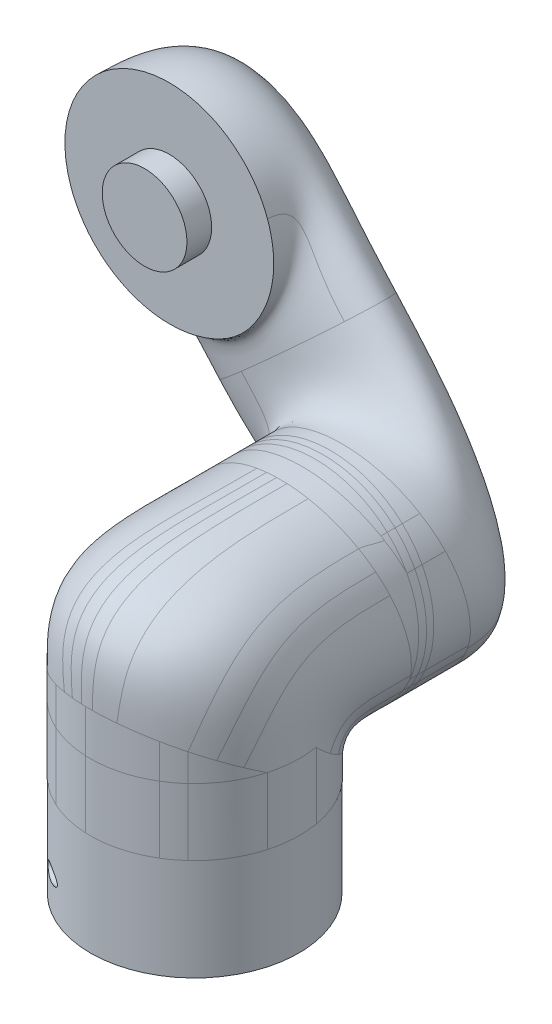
SolidWorks part; units mm, degrees
ref_plane "前视基准面" through (0, 0, 0) normal (0, 0, 1) x (1, 0, 0)
ref_plane "上视基准面" through (0, 0, 0) normal (0, 1, 0) x (1, 0, 0)
ref_plane "右视基准面" through (0, 0, 0) normal (1, 0, 0) x (0, 0, -1)
imported_body "输入1"
sketch "草图1" plane through (0, 0, -31.7494) normal (0, 0, 1) x (1, 0, 0)
  circle A0 centre (-49.5374, 45.2993) radius 42.262
  circle A1 centre (-49.5374, 45.2993) radius 17.15
  spline S0 degree 3 number of poles 68 (-9.7924, 59.6662) -> (-89.2606, 30.8722) construction
  spline S1 degree 3 number of poles 68 (-9.7924, 59.6662) -> (-89.2606, 30.8722)
  spline S2 degree 3 poles (1904.6401, 69.0479) (352.7628, -102.0182) (-74.7863, -68.8863) (-91.5199, 40.2563) (-91.6624, 41.6297) (-91.7749, 43.708) (-91.7956, 44.4051) (-91.8022, 45.8001) (-91.7883, 46.4949) (-91.6337, 49.9552) (-91.2418, 52.6808) (-90.4194, 56.0349) (-90.2382, 56.703) (-89.8415, 58.0339) (-89.6255, 58.6983) (-88.9303, 60.6698) (-88.4057, 61.951) (-86.6534, 65.6985) (-85.2496, 68.0696) (-83.193, 70.8705) (-82.7652, 71.4239) (-81.8867, 72.504) (-81.4357, 73.0312) (-80.0484, 74.5749) (-78.1072, 76.5327) (-75.9849, 78.2915) (-74.3245, 79.5352) (-73.7597, 79.9372) (-72.6065, 80.7156) (-72.0171, 81.0926) (-69.0421, 82.8929) (-66.5549, 84.0801) (-62.6674, 85.4914) (-61.3452, 85.8996) (-59.3214, 86.4163) (-58.6396, 86.5724) (-57.2778, 86.8492) (-56.5958, 86.9704) (-53.1803, 87.4911) (-50.4308, 87.6387) (-46.9723, 87.4847) (-46.2795, 87.4368) (-44.8918, 87.3061) (-44.1982, 87.2234) (-42.1368, 86.9261) (-40.781, 86.6618) (-36.7683, 85.6745) (-34.1654, 84.7592) (-30.3733, 82.9862) (-29.1455, 82.3359) (-26.7713, 80.9262) (-25.623, 80.166) (-23.4033, 78.5356) (-22.332, 77.6655) (-20.2679, 75.8129) (-19.2719, 74.8258) (-16.4659, 71.756) (-14.8167, 69.5507) (-12.6709, 66.0073) (-12.0098, 64.7849) (47.6121, -59.9345) (-505.0667, -442.0927) (-1649.0052, -1074.3051) knots -2.411715 -2.411715 -2.411715 -2.411715 0.0625 0.0625 0.09375 0.09375 0.109375 0.109375 0.125 0.125 0.1875 0.1875 0.203125 0.203125 0.21875 0.21875 0.25 0.25 0.3125 0.3125 0.328125 0.328125 0.34375 0.34375 0.375 0.40625 0.40625 0.421875 0.421875 0.4375 0.4375 0.5 0.5 0.53125 0.53125 0.546875 0.546875 0.5625 0.5625 0.625 0.625 0.640625 0.640625 0.65625 0.65625 0.6875 0.6875 0.75 0.75 0.78125 0.78125 0.8125 0.8125 0.84375 0.84375 0.875 0.875 0.9375 0.9375 0.96875 0.96875 4.032012 4.032012 4.032012 4.032012 only from (-89.2606, 30.8722) to (-9.7924, 59.6662) construction
  spline S3 degree 3 poles (-89.2606, 30.8722) (-90.214, 33.4974) (-90.8937, 36.1724) (-91.5199, 40.2563) (-91.6624, 41.6297) (-91.7749, 43.708) (-91.7956, 44.4051) (-91.8022, 45.8001) (-91.7883, 46.4949) (-91.6337, 49.9552) (-91.2418, 52.6808) (-90.4194, 56.0349) (-90.2382, 56.703) (-89.8415, 58.0339) (-89.6255, 58.6983) (-88.9303, 60.6698) (-88.4057, 61.951) (-86.6534, 65.6985) (-85.2496, 68.0696) (-83.193, 70.8705) (-82.7652, 71.4239) (-81.8867, 72.504) (-81.4357, 73.0312) (-80.0484, 74.5749) (-78.1072, 76.5327) (-75.9849, 78.2915) (-74.3245, 79.5352) (-73.7597, 79.9372) (-72.6065, 80.7156) (-72.0171, 81.0926) (-69.0421, 82.8929) (-66.5549, 84.0801) (-62.6674, 85.4914) (-61.3452, 85.8996) (-59.3214, 86.4163) (-58.6396, 86.5724) (-57.2778, 86.8492) (-56.5958, 86.9704) (-53.1803, 87.4911) (-50.4308, 87.6387) (-46.9723, 87.4847) (-46.2795, 87.4368) (-44.8918, 87.3061) (-44.1982, 87.2234) (-42.1368, 86.9261) (-40.781, 86.6618) (-36.7683, 85.6745) (-34.1654, 84.7592) (-30.3733, 82.9862) (-29.1455, 82.3359) (-26.7713, 80.9262) (-25.623, 80.166) (-23.4033, 78.5356) (-22.332, 77.6655) (-20.2679, 75.8129) (-19.2719, 74.8258) (-16.4659, 71.756) (-14.8167, 69.5507) (-12.6709, 66.0073) (-12.0098, 64.7849) (-10.8056, 62.2659) (-10.2672, 60.9795) (-9.7924, 59.6662) knots 0 0 0 0 0.0625 0.0625 0.09375 0.09375 0.109375 0.109375 0.125 0.125 0.1875 0.1875 0.203125 0.203125 0.21875 0.21875 0.25 0.25 0.3125 0.3125 0.328125 0.328125 0.34375 0.34375 0.375 0.40625 0.40625 0.421875 0.421875 0.4375 0.4375 0.5 0.5 0.53125 0.53125 0.546875 0.546875 0.5625 0.5625 0.625 0.625 0.640625 0.640625 0.65625 0.65625 0.6875 0.6875 0.75 0.75 0.78125 0.78125 0.8125 0.8125 0.84375 0.84375 0.875 0.875 0.9375 0.9375 0.96875 0.96875 1 1 1 1
extrude "凸台-拉伸1" add sketch "草图1" along normal blind 10 contours A1
